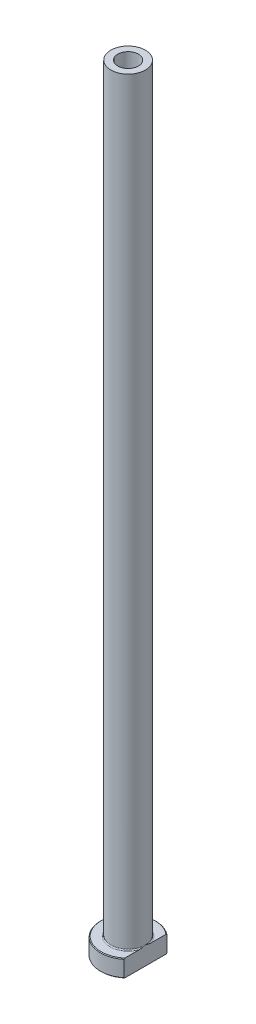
SolidWorks part; units mm, degrees
ref_plane "Front Plane" through (0, 0, 0) normal (0, 0, 1) x (1, 0, 0)
ref_plane "Top Plane" through (0, 0, 0) normal (0, 1, 0) x (1, 0, 0)
ref_plane "Right Plane" through (0, 0, 0) normal (1, 0, 0) x (0, 0, -1)
sketch "Sketch1" plane through (0, 0, 0) normal (0, 0, 1) x (1, 0, 0)
  line L0 (-3, 225) -> (-5, 225)
  line L1 (-5, 225) -> (-5, 5)
  line L2 (-5, 5) -> (-8, 5)
  line L3 (-8, 5) -> (-8, 0)
  line L4 (7.15, 0) -> (-7.15, 0) construction
  line L5 (-8, 0) -> (-3.25, 0)
  line L6 (-3, 180) -> (-3, 225)
  line L7 (0, 92.1877) -> (0, -15.5353) construction
  line L8 (0, -8.8) -> (0, 8.8) construction
  line L9 (-3, 180) -> (-3.25, 168)
  line L10 (-3.25, 168) -> (-3.25, 0)
  dimension "D1" = 0.25
  dimension "ID" = 6
  dimension "OD" = 10
  dimension "L" = 225
  dimension "H" = 16
  dimension "T" = 5
  dimension "N" = 45
  dimension "D2" = 12
  dimension "L-N" = 180
revolve "Revolve1" add sketch "Sketch1" angle 360 about L7
fillet "Fillet1" radius 0.3 1 edges at (0, 5, 5)
chamfer "Chamfer1" distance 0.2 angle 45 2 edges at (0, 5, 8) (0, 0, 8)
sketch "Sketch2" plane through (0, 0, 0) normal (0, -1, 0) x (1, 0, 0)
  line L0 (5, 6.245) -> (5, -6.245)
  circle A0 centre (0, 0) radius 8 construction
  arc A1 (5, 6.245) -> (5, -6.245) centre (0, 0) cw
  circle A2 centre (0, 0) radius 5 construction
extrude "Cut-Extrude1" cut sketch "Sketch2" against normal through all
chamfer "Chamfer2" distance 0.5 angle 45 1 edges at (0, 0, 3.25)
